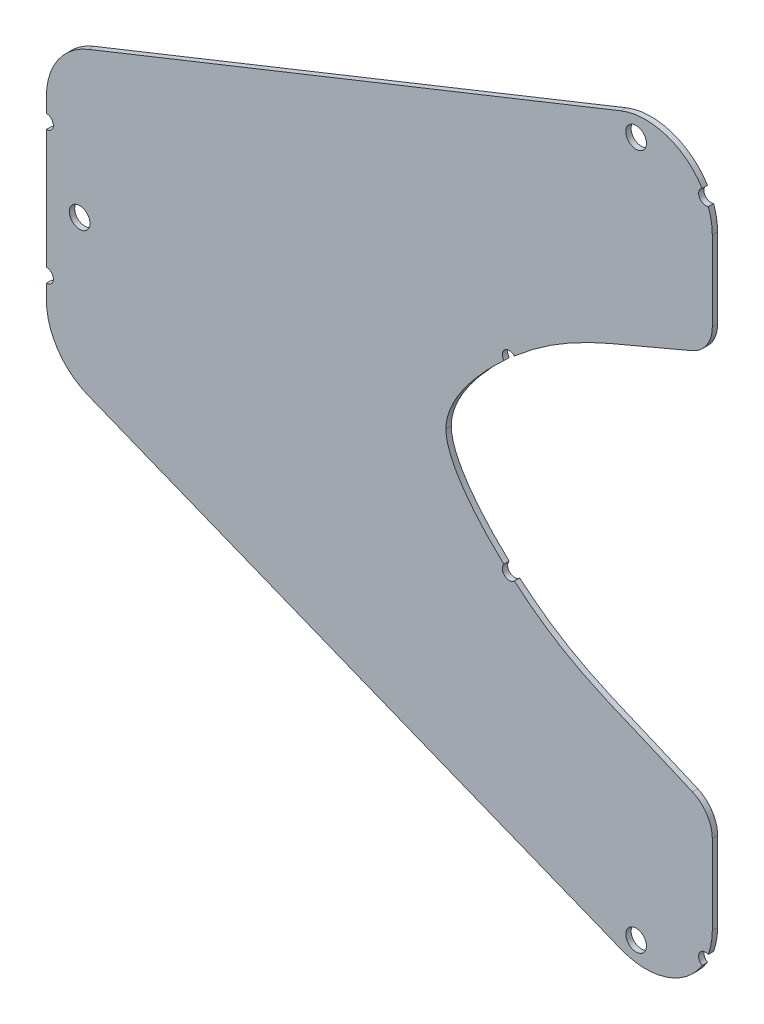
SolidWorks part; units mm, degrees
ref_plane "Plan de face" through (0, 0, 0) normal (0, 0, 1) x (1, 0, 0)
ref_plane "Plan de dessus" through (0, 0, 0) normal (0, 1, 0) x (1, 0, 0)
ref_plane "Plan de droite" through (0, 0, 0) normal (1, 0, 0) x (0, 0, -1)
sketch "Esquisse1" plane through (0, 0, 0) normal (0, 0, 1) x (1, 0, 0)
  line L0 (-12.8896, 0) -> (113.8155, 0) construction
  line L1 (0, 28.2689) -> (0, -8.95) construction
  line L2 (100, 66.1543) -> (100, -74.0345) construction
  line L3 (92.079, 50) -> (129.4811, 50) construction
  line L4 (4.9958, 10) -> (-26.9688, 10) construction
  line L5 (60, 10) -> (60, -30.9866) construction
  line L6 (0, 10) -> (100, 50) construction
  line L7 (0, 13.2297) -> (0, 11.05)
  line L8 (94.1434, 30) -> (136.8699, 30) construction
  line L9 (100, 45.2297) -> (100, 33.256)
  line L10 (-20.9086, 8.4055) -> (132.3051, 69.691) construction
  line L11 (92.079, 60) -> (129.4811, 60) construction
  line L12 (-26.9688, 20) -> (7.2836, 20) construction
  line L13 (86.2861, 54.5144) -> (6.2861, 22.5144)
  line L14 (94.1434, 20) -> (128.1966, 20) construction
  line L15 (100, 20) -> (0, 0) construction
  line L16 (86.2861, -54.5144) -> (6.2861, -22.5144)
  line L17 (100, -45.2297) -> (100, -33.256)
  line L18 (0, 8.95) -> (0, -8.95)
  line L19 (0, -11.05) -> (0, -13.2297)
  line L20 (0, -11.05) -> (0, -58.5509) construction
  arc A0 (0, 8.95) -> (0, 11.05) centre (0, 10) ccw
  arc A1 (86.2861, 54.5144) -> (98.4877, 50.5173) centre (90, 45.2297) cw
  arc A2 (70.2754, 14.6325) -> (68.7064, 13.2393) centre (69.5193, 13.9039) ccw
  arc A3 (6.2861, 22.5144) -> (0, 13.2297) centre (10, 13.2297) ccw
  circle A4 centre (5, 0) radius 1.55
  arc A5 (98.4877, 50.5173) -> (99.4038, 48.6309) centre (98.9954, 49.5981) ccw
  arc A7 (99.4038, 48.6309) -> (100, 45.2297) centre (90, 45.2297) cw
  circle A8 centre (88.559, 52.1925) radius 1.55
  arc A10 (100, 33.256) -> (97.0261, 28.6849) centre (95, 33.256) cw
  arc A11 (6.2861, -22.5144) -> (0, -13.2297) centre (10, -13.2297) cw
  arc A12 (86.2861, -54.5144) -> (98.4877, -50.5173) centre (90, -45.2297) ccw
  arc A13 (98.4877, -50.5173) -> (99.4038, -48.6309) centre (98.9954, -49.5981) cw
  arc A14 (99.4038, -48.6309) -> (100, -45.2297) centre (90, -45.2297) ccw
  arc A15 (100, -33.256) -> (97.0261, -28.6849) centre (95, -33.256) ccw
  circle A16 centre (88.559, -52.1925) radius 1.55
  arc A17 (70.2754, -14.6325) -> (68.7064, -13.2393) centre (69.5193, -13.9039) cw
  arc A19 (0, -8.95) -> (0, -11.05) centre (0, -10) cw
  spline S0 degree 3 poles (97.0261, 28.6849) (85.709, 23.6688) (79.068, 21.9752) (70.6637, 14.9651) (70.2754, 14.6325) knots 0.049678 0.049678 0.049678 0.049678 0.617749 0.645174 0.645174 0.645174 0.645174
  spline S1 degree 3 poles (68.7064, -13.2393) (64.2193, -9.1086) (60.0184, -3.9285) (60, 0) knots 0.682097 0.682097 0.682097 0.682097 1 1 1 1
  spline S2 degree 3 poles (68.7064, 13.2393) (64.2193, 9.1086) (60.0184, 3.9285) (60, 0) knots 0.682097 0.682097 0.682097 0.682097 1 1 1 1
  spline S3 degree 3 poles (97.0261, -28.6849) (85.709, -23.6688) (79.068, -21.9752) (70.6637, -14.9651) (70.2754, -14.6325) knots 0.049678 0.049678 0.049678 0.049678 0.617749 0.645174 0.645174 0.645174 0.645174
  point P22 (100, 50)
  point P25 (0, 10)
  point P39 (0, 20)
  point P40 (100, 60)
  point P45 (0, 0)
  dimension "D1" = 10
  dimension "D2" = 5
  dimension "D4" = 3
  dimension "D3" = 10
extrude "Extrusion1" add sketch "Esquisse1" along normal blind 0.8
